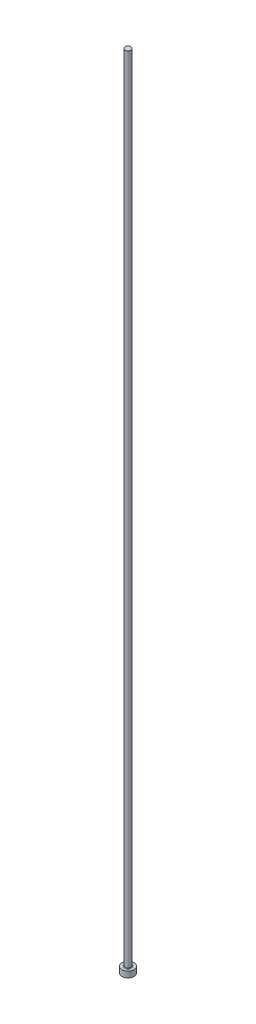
SolidWorks part; units mm, degrees
ref_plane "Plano frontal" through (0, 0, 0) normal (0, 0, 1) x (1, 0, 0)
ref_plane "Plano superior" through (0, 0, 0) normal (0, 1, 0) x (1, 0, 0)
ref_plane "Plano direito" through (0, 0, 0) normal (1, 0, 0) x (0, 0, -1)
sketch "Esboço1" plane through (0, 0, 0) normal (0, 0, 1) x (1, 0, 0)
  line L0 (0, 0) -> (3, 0)
  line L1 (3, 0) -> (3, 3)
  line L2 (3, 3) -> (1.8, 3)
  line L3 (1.5, 3.3) -> (1.5, 400)
  line L4 (1.5, 400) -> (0, 400)
  line L5 (0, 400) -> (0, 0) construction
  line L6 (0, 0) -> (0, 400)
  arc A0 (1.8, 3) -> (1.5, 3.3) centre (1.8, 3.3) cw
  dimension "D3" = 0.3
  dimension "D1" = 6
  dimension "D2" = 3
  dimension "D4" = 3
  dimension "D5" = 400
revolve "Revolução1" add sketch "Esboço1" angle 360 about L5
sketch "Esboço2"
  dimension "D1" = 1.6125
  dimension "D2" = 0.3375
  dimension "D3" = 0.525
  dimension "D4" = 0.225
wrap "Envolver1" sketch "Esboço2" wrap type deboss source sketch "Esboço2" thickness 0.1 parameters "D1"=0.1
